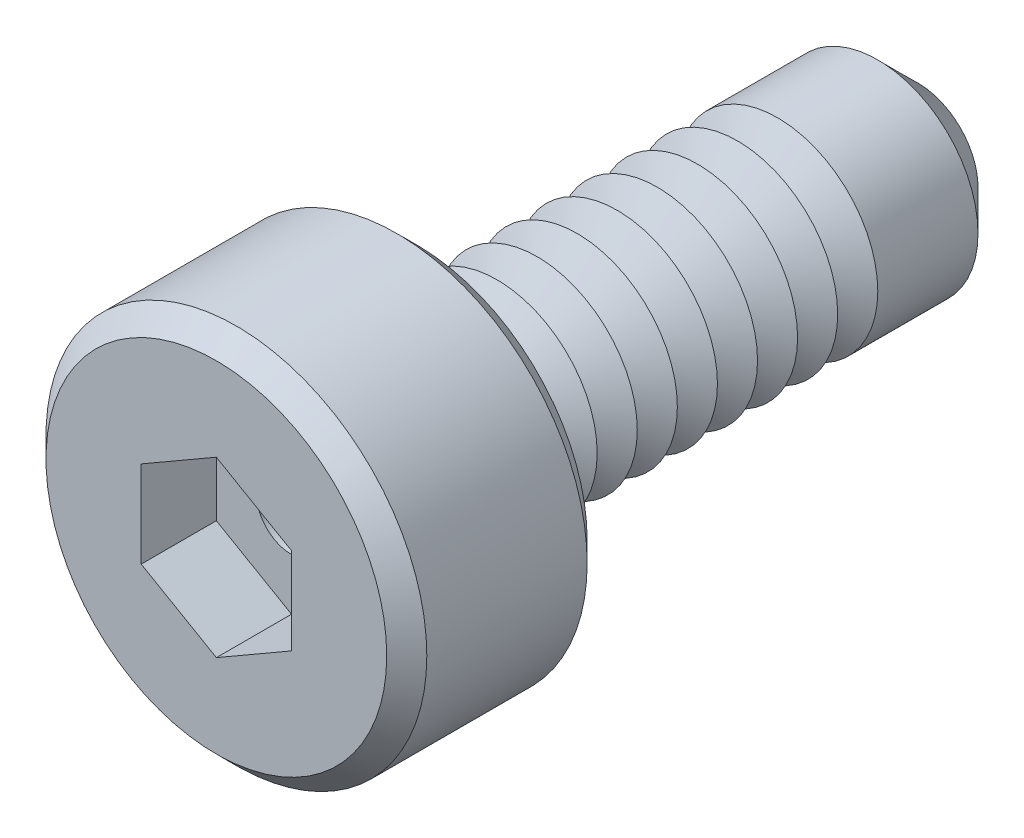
SolidWorks part; units mm, degrees
ref_plane "Front Plane" through (0, 0, 0) normal (0, 0, 1) x (1, 0, 0)
ref_plane "Top Plane" through (0, 0, 0) normal (0, 1, 0) x (1, 0, 0)
ref_plane "Right Plane" through (0, 0, 0) normal (1, 0, 0) x (0, 0, -1)
sketch "Sketch1" plane through (0, 0, 0) normal (0, 0, 1) x (1, 0, 0)
  circle A0 centre (0, 0) radius 1.9
  dimension "D1" = 3.8
extrude "Boss-Extrude1" add sketch "Sketch1" along normal blind 2
sketch "Sketch2" plane through (0, 0, 0) normal (0, 0, -1) x (-1, 0, 0)
  circle A0 centre (0, 0) radius 1
  dimension "D1" = 2
extrude "Boss-Extrude2" add sketch "Sketch2" along normal blind 5
chamfer "Chamfer1" distance 0.4 angle 45 1 edges at (-1, 0, -5)
sketch "Sketch3" plane through (0, 0, 0) normal (1, 0, 0) x (0, 0, -1)
  line L0 (-2.5121, 0) -> (4.5776, 0) construction
sketch "Sketch4" plane through (0, 0, 0) normal (1, 0, 0) x (0, 0, -1)
  line L0 (0, 1) -> (0.2, 0.6536)
  line L1 (0.2, 0.6536) -> (0.4, 1)
  line L2 (4.6, 1) -> (0, 1) construction
  line L3 (0.4, 1) -> (0, 1)
  dimension "D1" = 0.4
revolve "Cut-Revolve1" cut sketch "Sketch4" angle 360 about L0
pattern_linear "LPattern1" count 9 spacing 0.4 along (0, 0, -1) of "Cut-Revolve1"
sketch "Sketch5" plane through (0, 0, 2) normal (0, 0, 1) x (1, 0, 0)
  line L1 (0, 0.866) -> (-0.75, 0.433)
  line L2 (-0.75, 0.433) -> (-0.75, -0.433)
  line L3 (-0.75, -0.433) -> (0, -0.866)
  line L4 (0, -0.866) -> (0.75, -0.433)
  line L5 (0.75, -0.433) -> (0.75, 0.433)
  line L6 (0.75, 0.433) -> (0, 0.866)
  circle A0 centre (0, 0) radius 0.75 construction
  dimension "D1" = 1.5
extrude "Cut-Extrude1" cut sketch "Sketch5" against normal blind 0.75
sketch "Sketch6" plane through (0, 0, 1.25) normal (0, 0, 1) x (1, 0, 0)
  circle A0 centre (0, 0) radius 0.35
  dimension "D1" = 0.7
extrude "Cut-Extrude2" cut sketch "Sketch6" against normal up to surface (6.25 mm away)
chamfer "Chamfer2" distance 0.2 angle 45 2 edges at (1.9, 0, 0) (1.9, 0, 2)
